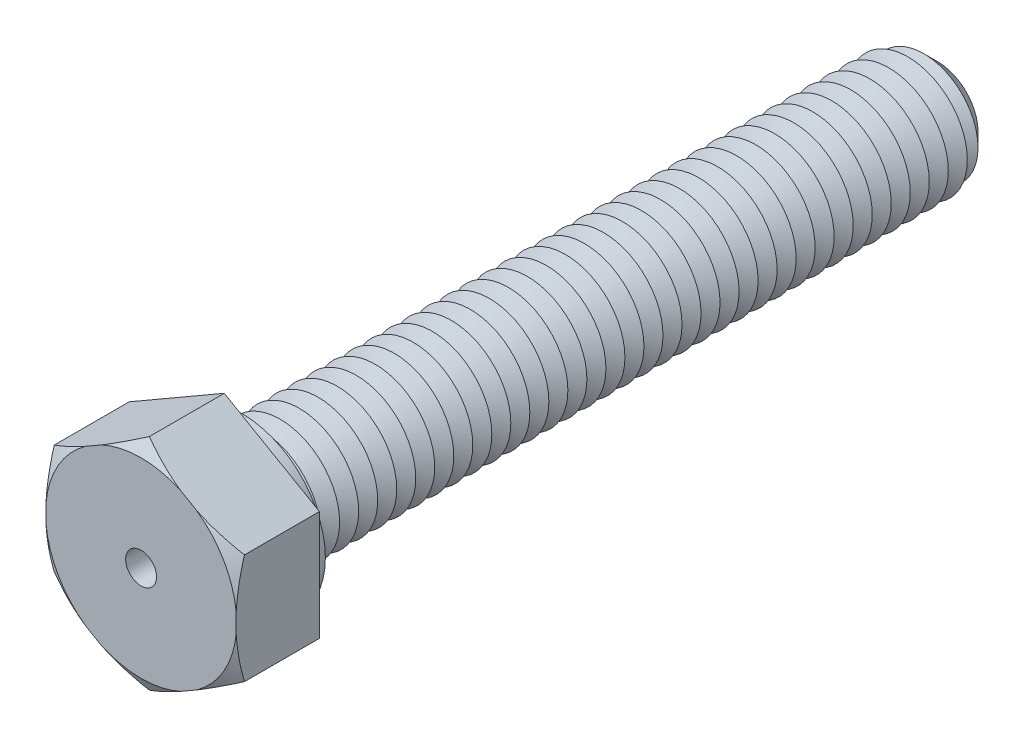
SolidWorks part; units mm, degrees
ref_plane "Front Plane" through (0, 0, 0) normal (0, 0, 1) x (1, 0, 0)
ref_plane "Top Plane" through (0, 0, 0) normal (0, 1, 0) x (1, 0, 0)
ref_plane "Right Plane" through (0, 0, 0) normal (1, 0, 0) x (0, 0, -1)
sketch "Sketch2" plane through (0, 0, 0) normal (0, 0, 1) x (1, 0, 0)
  line L1 (0, 4.6188) -> (-4, 2.3094)
  line L2 (-4, 2.3094) -> (-4, -2.3094)
  line L3 (-4, -2.3094) -> (0, -4.6188)
  line L4 (0, -4.6188) -> (4, -2.3094)
  line L5 (4, -2.3094) -> (4, 2.3094)
  line L6 (4, 2.3094) -> (0, 4.6188)
  circle A0 centre (0, 0) radius 4 construction
  dimension "D1" = 8
extrude "Boss-Extrude1" add sketch "Sketch2" along normal blind 3.5
sketch "Sketch3" plane through (0, 0, 0) normal (0, 0, -1) x (-1, 0, 0)
  circle A0 centre (0, 0) radius 2.5
  dimension "D1" = 5
extrude "Boss-Extrude2" add sketch "Sketch3" along normal blind 30
sketch "Sketch4" plane through (0, 0, 0) normal (0, 0, -1) x (-1, 0, 0)
  circle A0 centre (0, 0) radius 3.5
  dimension "D1" = 7
extrude "Boss-Extrude3" add sketch "Sketch4" along normal blind 0.75
sketch "Sketch5" plane through (0, 0, 0) normal (1, 0, 0) x (0, 0, -1)
  line L0 (-3.2117, 0) -> (6.3192, 0) construction
chamfer "Chamfer1" distance 0.8 angle 45 1 edges at (-2.5, 0, -30)
sketch "Sketch6" plane through (0, 0, 0) normal (1, 0, 0) x (0, 0, -1)
  line L0 (0.75, 2.5) -> (1.15, 1.8072)
  line L1 (1.15, 1.8072) -> (1.55, 2.5)
  line L2 (29.2, 2.5) -> (0.75, 2.5) construction
  line L3 (1.55, 2.5) -> (0.75, 2.5)
  dimension "D1" = 0.8
revolve "Cut-Revolve1" cut sketch "Sketch6" angle 360 about L0
pattern_linear "LPattern1" count 36 spacing 0.8 along (0, 0, -1) of "Cut-Revolve1"
sketch "Sketch7" plane through (0, 0, 0) normal (1, 0, 0) x (0, 0, -1)
  line L0 (-3.5, 4.6188) -> (-3.5, 4.0188)
  line L1 (-3.5, 2.3094) -> (-3.5, 4.6188) construction
  line L2 (-3.5, 4.0188) -> (-3.1536, 4.6188)
  line L3 (-3.5, 4.6188) -> (0, 4.6188) construction
  line L4 (-3.1536, 4.6188) -> (-3.5, 4.6188)
  dimension "D1" = 0.6
  dimension "D2" = 30
revolve "Cut-Revolve2" cut sketch "Sketch7" angle 360 about L0
sketch "Sketch8" plane through (0, 0, 3.5) normal (0, 0, 1) x (1, 0, 0)
  circle A0 centre (0, 0) radius 0.65
  dimension "D1" = 1.3
extrude "Cut-Extrude1" cut sketch "Sketch8" against normal up to surface (33.5 mm away)
